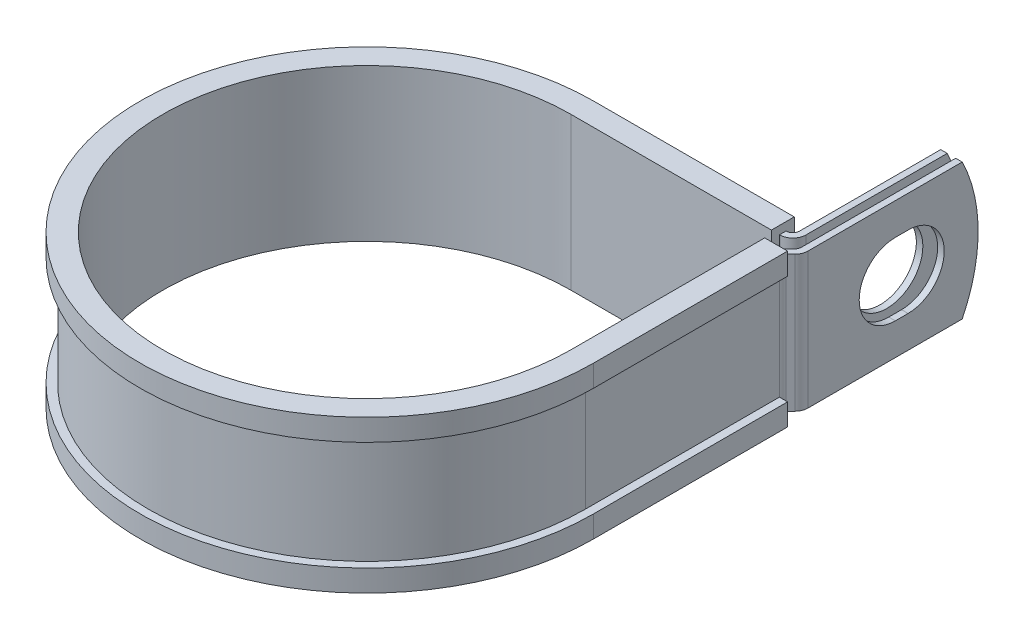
SolidWorks part; units mm, degrees
ref_plane "Front Plane" through (0, 0, 0) normal (0, 0, 1) x (1, 0, 0)
ref_plane "Top Plane" through (0, 0, 0) normal (0, 1, 0) x (1, 0, 0)
ref_plane "Right Plane" through (0, 0, 0) normal (1, 0, 0) x (0, 0, -1)
sketch "Sketch1" plane through (0, 0, 0) normal (0, 1, 0) x (1, 0, 0)
  line L0 (0, 39.624) -> (37.5083, 39.624)
  line L1 (39.624, 0) -> (39.624, 36.2115)
  line L2 (39.9467, 71.4248) -> (39.9467, 42.0624)
  line L3 (40.3382, 37.9357) -> (41.1644, 38.7619)
  line L5 (41.5215, 39.624) -> (41.5215, 71.4248)
  arc A0 (0, 39.624) -> (39.624, 0) centre (0, 0) ccw
  arc A1 (40.3382, 37.9357) -> (39.624, 36.2115) centre (42.0624, 36.2115) ccw
  arc A2 (41.1644, 38.7619) -> (41.5215, 39.624) centre (40.3023, 39.624) ccw
  arc A3 (37.5083, 39.624) -> (39.9467, 42.0624) centre (37.5083, 42.0624) ccw
extrude "Extrude-Thin1" add sketch "Sketch1" along normal mid plane 25.4 thin
sketch "Sketch2" plane through (38.7275, 0, 0) normal (-1, 0, 0) x (0, 0, 1)
  line L0 (-71.4248, 12.7) -> (-71.4248, -12.7) construction
  line L1 (0, 12.7) -> (0, -12.7) construction
  circle A0 centre (-57.15, 0) radius 6.7437
  point P2 (-71.4248, 0)
extrude "Cut-Extrude1" cut sketch "Sketch2" against normal up to surface (1.2192 mm away)
sketch "Sketch3" plane through (42.7407, 0, 0) normal (1, 0, 0) x (0, 0, -1)
  line L0 (55.9562, 0) -> (58.3438, 0) construction
  line L1 (55.9562, 6.7437) -> (58.3438, 6.7437)
  line L2 (55.9562, -6.7437) -> (58.3438, -6.7437)
  line L3 (71.4248, 12.7) -> (71.4248, -12.7) construction
  arc A0 (55.9562, 6.7437) -> (55.9562, -6.7437) centre (55.9562, 0) ccw
  arc A1 (58.3438, -6.7437) -> (58.3438, 6.7437) centre (58.3438, 0) ccw
  point P3 (57.15, 0)
  point P8 (71.4248, 0)
  point P11 (49.2125, 0)
  point P12 (65.0875, 0)
extrude "Cut-Extrude2" cut sketch "Sketch3" against normal up to surface (1.2192 mm away)
sketch "Sketch4" plane through (38.7275, 0, 0) normal (-1, 0, 0) x (0, 0, 1)
  line L0 (-71.4248, 12.7) -> (-71.4248, -12.7)
  line L1 (-71.4248, 12.7) -> (-68.4475, 12.7)
  line L2 (-71.4248, 12.7) -> (-42.0624, 12.7) construction
  line L3 (-71.4248, -12.7) -> (-68.4475, -12.7)
  line L4 (-71.4248, -12.7) -> (-42.0624, -12.7) construction
  arc A0 (-68.4475, 12.7) -> (-68.4475, -12.7) centre (-42.8498, 0) ccw
extrude "Cut-Extrude3" cut sketch "Sketch4" against normal through all contours A0 M4 M5 | A0 L0 M2
ref_plane "Plane1" through (0, 0, -36.2115) normal (0, 0, -1) x (-1, 0, 0)
ref_plane "Plane2" through (37.4575, 0, 0) normal (-1, 0, 0) x (0, 0, 1)
sketch "Sketch5" plane through (0, 0, -36.2115) normal (0, 0, -1) x (-1, 0, 0)
  line L0 (-40.8432, 12.7) -> (-39.624, 12.7)
  line L1 (-40.8432, 12.7) -> (-40.8432, -12.7) construction
  line L3 (-39.624, 12.7) -> (-39.624, -12.7)
  line L4 (-39.624, -12.7) -> (-40.8432, -12.7)
  line L5 (-40.8432, -12.7) -> (-40.8432, -10.16)
  line L6 (-40.8432, 12.7) -> (-40.8432, 10.16)
  line L7 (-42.3672, 14.224) -> (-42.3672, 10.16)
  line L8 (-42.3672, 14.224) -> (-38.1, 14.224)
  line L9 (-38.1, 14.224) -> (-38.1, -14.224)
  line L10 (-38.1, -14.224) -> (-42.3672, -14.224)
  line L11 (-42.3672, -14.224) -> (-42.3672, -10.16)
  line L12 (-42.3672, 10.16) -> (-40.8432, 10.16)
  line L13 (-40.8432, -10.16) -> (-42.3672, -10.16)
sketch "Sketch6" plane through (0, 12.7, 0) normal (0, 1, 0) x (1, 0, 0)
  line L0 (38.1, 0) -> (38.1, 36.2115)
  line L1 (38.1, 36.2115) -> (42.3672, 36.2115) construction
  line L2 (37.4575, 6.9878) -> (37.4575, -6.9878) construction
  line L5 (0, 38.1) -> (37.4575, 38.1)
  arc A0 (0, 38.1) -> (38.1, 0) centre (0, 0) ccw
sweep "Sweep1" add profiles "Sketch5" path "Sketch6"
equation "\"D4@Sketch5\" = \"D1@Extrude-Thin1\""
equation "\"D5@Sketch5\" = \"D5@Extrude-Thin1\""
equation "\"D1@Sketch3\" = \"D2@Sketch2\""
equation "\"D7@Sketch1\" = \"D3@Sketch2\" + \"D1@Sketch3\""
equation "\"D1@Sketch1\" = \"D1@Sketch6\" + 2 * \"D3@Sketch5\""
equation "\"D1@Sketch4\" = ( \"D1@Extrude-Thin1\" + .125 ) * 2"
equation "\"D9@Sketch1\"= \"D5@Extrude-Thin1\""
equation "\"D8@Sketch1\"= 2 * \"D5@Extrude-Thin1\""
equation "\"D2@Sketch1\" = 2 * \"D5@Extrude-Thin1\""
equation "\"D2@Sketch3\" = \"D1@Sketch2\""
